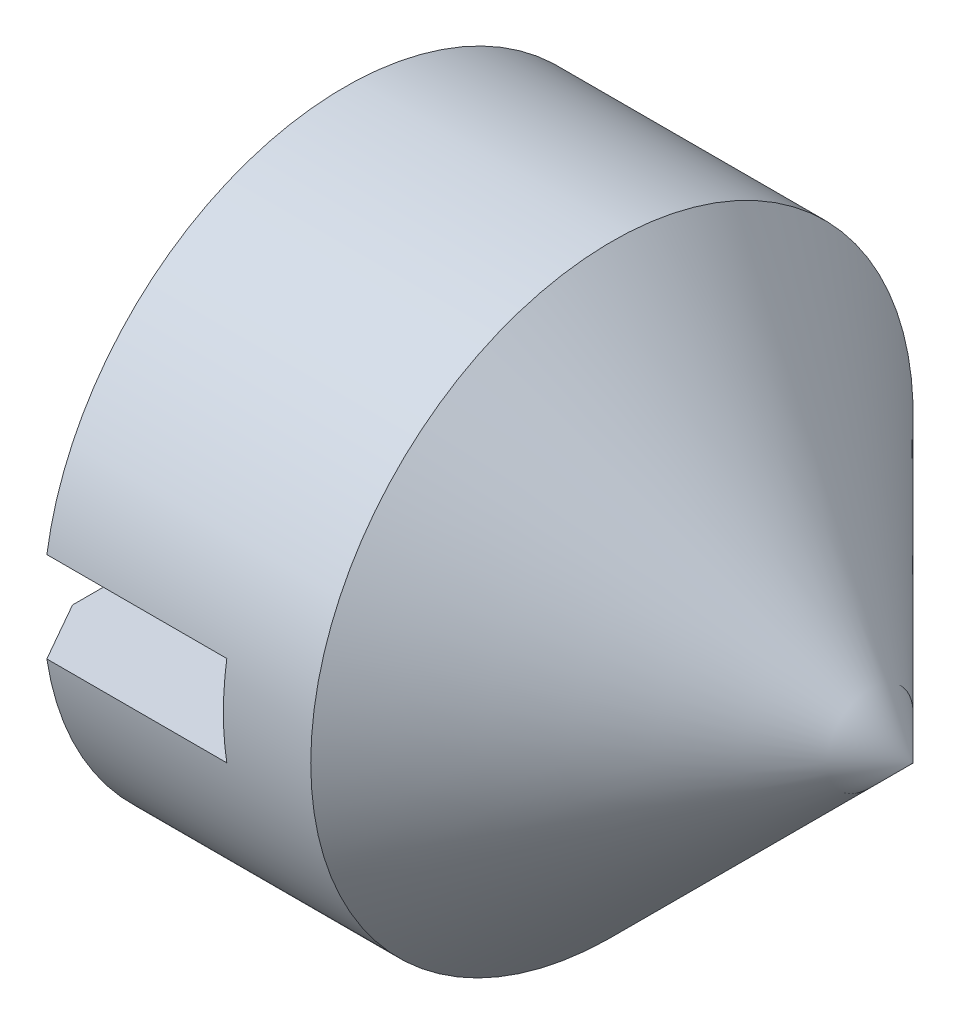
SolidWorks part; units mm, degrees
revolve "BaseBody" add sketch "BodySke"
sketch "BodySke" plane through (0, 0, 0) normal (0, 0, 1) x (1, 0, 0)
  line L0 (0, 0) -> (0, 1.61)
  line L1 (0, 1.61) -> (0.2252, 2)
  line L2 (0.2252, 2) -> (2, 2)
  line L3 (2, 2) -> (4, 0)
  line L4 (4, 0) -> (0, 0)
  line L5 (-12.7, 0) -> (88.9, 0) construction
  line L6 (2, -2) -> (4, 0) construction
  line L7 (0.35, 15.875) -> (0.35, -3.175) construction
  line L8 (0, -1.61) -> (0.2252, -2) construction
extrude "Slot" cut sketch "Sketch2" against normal blind 1.42
sketch "Sketch2" plane through (0, 0, 0) normal (-1, 0, 0) x (0, 0, 1)
  line L0 (2, 0.3) -> (-2, 0.3)
  line L1 (2, -0.3) -> (2, 0.3)
  line L2 (-2, -0.3) -> (-2, 0.3)
  line L4 (2, -0.3) -> (-2, -0.3)
  circle A2 centre (0, 0) radius 2 construction
  dimension "D1" = 0.3
  dimension "Slot_width" = 0.6
ref_plane "Plane1" through (0, 0, 0) normal (0, 0, 1) x (1, 0, 0)
ref_plane "Plane2" through (0, 0, 0) normal (0, 1, 0) x (1, 0, 0)
ref_plane "Plane3" through (0, 0, 0) normal (1, 0, 0) x (0, 0, -1)
sketch "ThdSchSke" plane through (0, 0, 0) normal (0, 0, 1) x (1, 0, 0)
  line L0 (0.2252, -1.61) -> (-0.0479, -2)
  line L1 (0.2252, -1.61) -> (0.4982, -2)
  line L2 (0.4982, -2) -> (0.4982, -2.5)
  line L3 (-3.175, 0) -> (5.1513, 0) construction
  line L4 (0.2252, 2) -> (0.2252, -2) construction
  line L5 (0.4982, -2.5) -> (-0.0479, -2.5)
  line L6 (-0.0479, -2.5) -> (-0.0479, -2)
revolve "ThreadSchematic" [suppressed] cut sketch "ThdSchSke" angle 360 about L3
pattern_linear "ThdSchPat" [suppressed]
equation "\"Thread_minor@ThreadCosmetic\" = \"Minor_dia@BodySke\""
equation "\"Thread_minor@ThdSchSke\" = \"Thread_minor@ThreadCosmetic\""
equation "\"Diameter@ThdSchSke\" = \"Diameter@BodySke\""
equation "\"Overcut@ThdSchSke\" = \"Diameter@BodySke\" * 1.25"
equation "\"Num_threads@ThdSchPat\" = int( (\"Length@BodySke\" - ( ( ( \"Diameter@BodySke\" - \"Minor_dia@BodySke\" ) * 0.5 ) / tan( \"Drive_ch_ang@BodySke\" * 0.017453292 ) ) - ( ( \"Diameter@BodySke\" * 0.5 ) / tan( \"Con"
equation "\"Advance@ThdSchPat\" = (\"Length@BodySke\" - ( ( ( \"Diameter@BodySke\" - \"Minor_dia@BodySke\" ) * 0.5 ) / tan( \"Drive_ch_ang@BodySke\" * 0.017453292 ) ) - ( ( \"Diameter@BodySke\" * 0.5 ) / tan( \"Cone_ang@Bod"
equation "' \"Num_threads@ThdSchPat\" = \"Num_threads@ThdSchPat\" - sgn( \"Num_threads@ThdSchPat\" - 1) '---chamfered tips only---"
equation "\"D1@Sketch2\" = \"Slot_width@Sketch2\" / 2"
